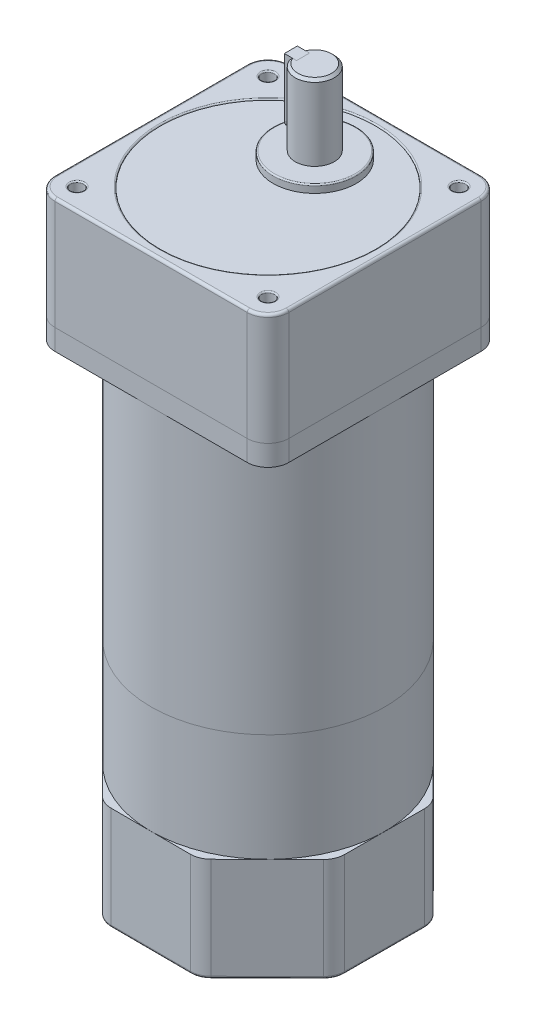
SolidWorks part; units mm, degrees
ref_plane "前视基准面" through (0, 0, 0) normal (0, 0, 1) x (1, 0, 0)
ref_plane "上视基准面" through (0, 0, 0) normal (0, 1, 0) x (1, 0, 0)
ref_plane "右视基准面" through (0, 0, 0) normal (1, 0, 0) x (0, 0, -1)
sketch "草图1" plane through (0, 0, 0) normal (0, 1, 0) x (1, 0, 0)
  line L1 (-37, -45) -> (37, -45)
  line L2 (-45, -37) -> (-45, 37)
  line L3 (-37, 45) -> (37, 45)
  line L4 (45, -37) -> (45, 37)
  line L5 (-45, -45) -> (45, 45) construction
  line L6 (-45, 45) -> (45, -45) construction
  arc A0 (-45, 37) -> (-37, 45) centre (-37, 37) cw
  arc A1 (-37, -45) -> (-45, -37) centre (-37, -37) cw
  arc A2 (37, 45) -> (45, 37) centre (37, 37) cw
  arc A3 (37, -45) -> (45, -37) centre (37, -37) ccw
  point P0 (0, 0)
  dimension "D1" = 8
extrude "凸台-拉伸1" add sketch "草图1" against normal blind 43
sketch "草图2" plane through (0, -43, 0) normal (0, -1, 0) x (1, 0, 0)
  line L0 (-37, 45) -> (37, 45) construction
  line L1 (-37, -45) -> (37, -45)
  line L2 (-45, -37) -> (-45, 37)
  line L3 (-37, 45) -> (37, 45)
  line L4 (45, -37) -> (45, 37)
  line L5 (-45, -45) -> (45, 45) construction
  line L6 (-45, 45) -> (45, -45) construction
  arc A0 (-37, -45) -> (-45, -37) centre (-37, -37) cw
  arc A1 (37, -45) -> (45, -37) centre (37, -37) ccw
  arc A2 (37, 45) -> (45, 37) centre (37, 37) cw
  arc A3 (-45, 37) -> (-37, 45) centre (-37, 37) cw
  point P0 (0, 0)
  dimension "D1" = 8
extrude "凸台-拉伸2" add sketch "草图2" along normal blind 8 separate body
sketch "草图3" plane through (0, -51, 0) normal (0, -1, 0) x (1, 0, 0)
  circle A0 centre (0, 0) radius 45
extrude "凸台-拉伸3" add sketch "草图3" along normal blind 100 separate body
sketch "草图4" plane through (0, -151, 0) normal (0, -1, 0) x (1, 0, 0)
  circle A0 centre (0, 0) radius 45
extrude "凸台-拉伸4" add sketch "草图4" along normal blind 41.5 separate body
sketch "草图5" plane through (0, -192.5, 0) normal (0, -1, 0) x (1, 0, 0)
  line L1 (15.1674, 45.0537) -> (-15.4843, 44.9458)
  line L2 (-21.1328, 42.5827) -> (-42.7305, 20.8324)
  line L3 (-45.0537, 15.1674) -> (-44.9458, -15.4843)
  line L4 (-42.5827, -21.1328) -> (-20.8324, -42.7305)
  line L5 (-15.1674, -45.0537) -> (15.4843, -44.9458)
  line L6 (21.1328, -42.5827) -> (42.7305, -20.8324)
  line L7 (45.0537, -15.1674) -> (44.9458, 15.4843)
  line L8 (42.5827, 21.1328) -> (20.8324, 42.7305)
  circle A0 centre (0, 0) radius 45 construction
  arc A1 (44.9458, 15.4843) -> (42.5827, 21.1328) centre (36.9458, 15.4561) ccw
  arc A2 (42.7305, -20.8324) -> (45.0537, -15.1674) centre (37.0537, -15.1955) ccw
  arc A3 (15.4843, -44.9458) -> (21.1328, -42.5827) centre (15.4561, -36.9458) ccw
  arc A4 (-20.8324, -42.7305) -> (-15.1674, -45.0537) centre (-15.1955, -37.0537) ccw
  arc A5 (-44.9458, -15.4843) -> (-42.5827, -21.1328) centre (-36.9458, -15.4561) ccw
  arc A6 (-42.7305, 20.8324) -> (-45.0537, 15.1674) centre (-37.0537, 15.1955) ccw
  arc A7 (15.1674, 45.0537) -> (20.8324, 42.7305) centre (15.1955, 37.0537) cw
  arc A8 (-15.4843, 44.9458) -> (-21.1328, 42.5827) centre (-15.4561, 36.9458) ccw
  dimension "D1" = 8
extrude "凸台-拉伸5" add sketch "草图5" along normal blind 40 separate body
fillet "圆角1" radius 1 16 edges at (44.9997, -232.5, 0.1584) (44.4555, -232.5, -18.231) (31.9316, -232.5, -31.7076) (18.5436, -232.5, -44.326) (0.1584, -232.5, -44.9997) (-18.231, -232.5, -44.4555) (-31.7076, -232.5, -31.9316) (-44.326, -232.5, -18.5436) (-44.9997, -232.5, -0.1584) (-44.4555, -232.5, 18.231) (-31.9316, -232.5, 31.7076) (-18.5436, -232.5, 44.326) (-0.1584, -232.5, 44.9997) (18.231, -232.5, 44.4555) (31.7076, -232.5, 31.9316) (44.326, -232.5, 18.5436)
fillet "圆角2" radius 1 8 edges at (0, 0, -45) (42.6569, 0, -42.6569) (45, 0, 0) (42.6569, 0, 42.6569) (0, 0, 45) (-42.6569, 0, 42.6569) (-45, 0, 0) (-42.6569, 0, -42.6569)
sketch "草图6" plane through (0, 0, 0) normal (0, 1, 0) x (1, 0, 0)
  point P19 (36.7696, -36.7696)
  point P20 (-36.7696, -36.7696)
  point P21 (-36.7696, 36.7696)
  point P22 (36.7696, 36.7696)
hole_wizard "M6 螺纹孔1" positions "3D草图1" profile "草图7" tap size "M6" standard "GB"
sketch3d "3D草图1"
  point P0 (36.7696, 0, 36.7696)
  point P3 (-36.7696, 0, 36.7696)
  point P6 (-36.7696, 0, -36.7696)
  point P9 (36.7696, 0, -36.7696)
sketch "草图7" plane through (36.7696, 0, 36.7696) normal (1, 0, 0) x (0, 0, 1)
  line L0 (0, 0) -> (0, 18.5022)
  line L1 (0, 18.5022) -> (2.5, 17)
  line L2 (2.5, 17) -> (2.5, 0)
  line L5 (2.5, 0) -> (0, 0)
  line L10 (0, 18.5022) -> (-2.5, 17) construction
  line L11 (0, -6.35) -> (0, 107.95) construction
  dimension "螺纹孔钻头直径" = 5
  dimension "螺纹孔钻头深度" = 17
  dimension "导头角度" = 118
sketch "草图8" plane through (0, -51, 0) normal (0, -1, 0) x (1, 0, 0)
  circle A1 centre (-36.7696, 36.7696) radius 3.5
  circle A2 centre (36.7696, 36.7696) radius 3.5
  circle A3 centre (36.7696, -36.7696) radius 3.5
  circle A4 centre (-36.7696, -36.7696) radius 3.5
extrude "切除-拉伸1" cut sketch "草图8" against normal blind 34
fillet "圆角3" radius 0.5 4 edges at (36.7696, 0, -34.2696) (-36.7696, 0, -34.2696) (-36.7696, 0, 39.2696) (36.7696, 0, 39.2696)
sketch "草图9" plane through (0, 0, 0) normal (0, 1, 0) x (1, 0, 0)
  circle A0 centre (0, 18) radius 16
extrude "凸台-拉伸6" add sketch "草图9" along normal blind 3 separate body
fillet "圆角4" radius 0.5 1 edges at (0, 3, -2)
sketch "草图10" plane through (0, 3, 0) normal (0, 1, 0) x (1, 0, 0)
  circle A0 centre (0, 18) radius 7.5
extrude "凸台-拉伸7" add sketch "草图10" along normal blind 29 separate body
sketch "草图11" plane through (0, 0, 0) normal (0, 1, 0) x (1, 0, 0)
  circle A0 centre (0, 0) radius 41.4
extrude "切除-拉伸2" cut sketch "草图11" against normal blind 0.5
fillet "圆角5" radius 0.5 1 edges at (0, 0, 41.4)
ref_plane "基准面2" through (-7.5, 0, 0) normal (1, 0, 0) x (0, 0, -1)
sketch "草图13" plane through (-7.5, 0, 0) normal (1, 0, 0) x (0, 0, -1)
  line L1 (25.5, 32) -> (10.5, 32) construction
  line L2 (20.5, 9.5) -> (20.5, 32)
  line L3 (20.5, 32) -> (15.5, 32)
  line L4 (15.5, 32) -> (15.5, 9.5)
  arc A0 (15.5, 9.5) -> (20.5, 9.5) centre (18, 9.5) ccw
extrude "切除-拉伸6" cut sketch "草图13" along normal blind 3
sketch "草图14" plane through (-4.5, 0, 0) normal (-1, 0, 0) x (0, 0, 1)
  line L0 (-20.5, 9.5) -> (-20.5, 32)
  line L1 (-20.5, 32) -> (-15.5, 32)
  line L2 (-15.5, 32) -> (-15.5, 9.5)
  arc A0 (-20.5, 9.5) -> (-15.5, 9.5) centre (-18, 9.5) ccw
extrude "凸台-拉伸8" add sketch "草图14" along normal blind 5 separate body
chamfer "倒角2" distance 0.3 angle 45 4 edges at (-9.5, 32, -18) (-9.5, 20.75, -20.5) (-9.5, 7, -18) (-9.5, 20.75, -15.5)
chamfer "倒角3" distance 1 angle 45 1 edges at (7.5, 32, -18)
